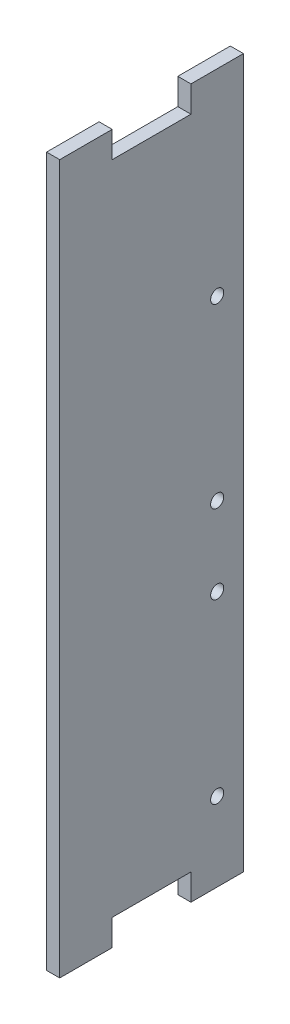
SolidWorks part; units mm, degrees
ref_plane "Front" through (0, 0, 0) normal (0, 0, 1) x (1, 0, 0)
ref_plane "Top" through (0, 0, 0) normal (0, 1, 0) x (1, 0, 0)
ref_plane "Right" through (0, 0, 0) normal (1, 0, 0) x (0, 0, -1)
sketch "Sketch1" plane through (0, 0, 0) normal (1, 0, 0) x (0, 0, -1)
  line L0 (-9.525, 0) -> (9.525, 0)
  line L1 (-9.525, 0) -> (-9.525, -6.35)
  line L2 (-9.525, -6.35) -> (-22.225, -6.35)
  line L3 (-22.225, -6.35) -> (-22.225, 165.1)
  line L4 (15.875, 55.5625) -> (15.875, 12.7) construction
  line L5 (15.875, 117.475) -> (15.875, 74.6125) construction
  line L8 (-22.225, 165.1) -> (-9.525, 165.1)
  line L9 (0, -1000) -> (0, 49000) construction
  line L10 (9.525, 165.1) -> (9.525, 158.75)
  line L11 (22.225, 165.1) -> (9.525, 165.1)
  line L13 (-9.525, 165.1) -> (-9.525, 158.75)
  line L14 (-9.525, 158.75) -> (9.525, 158.75)
  line L18 (22.225, -6.35) -> (22.225, 165.1)
  line L19 (9.525, -6.35) -> (22.225, -6.35)
  line L20 (9.525, 0) -> (9.525, -6.35)
  circle A0 centre (15.875, 12.7) radius 1.5875
  circle A1 centre (15.875, 55.5625) radius 1.5875
  circle A2 centre (15.875, 74.6125) radius 1.5875
  circle A3 centre (15.875, 117.475) radius 1.5875
  dimension "D4" = 3.175
  dimension "D9" = 3.175
  dimension "D1" = 6.35
  dimension "D2" = 12.7
  dimension "D3" = 165.1
  dimension "D5" = 19.05
  dimension "D6" = 42.8625
  dimension "D7" = 38.1
  dimension "D8" = 12.7
  dimension "D10" = 42.8625
  dimension "D11" = 19.05
extrude "Extrude1" add sketch "Sketch1" along normal blind 3.175
